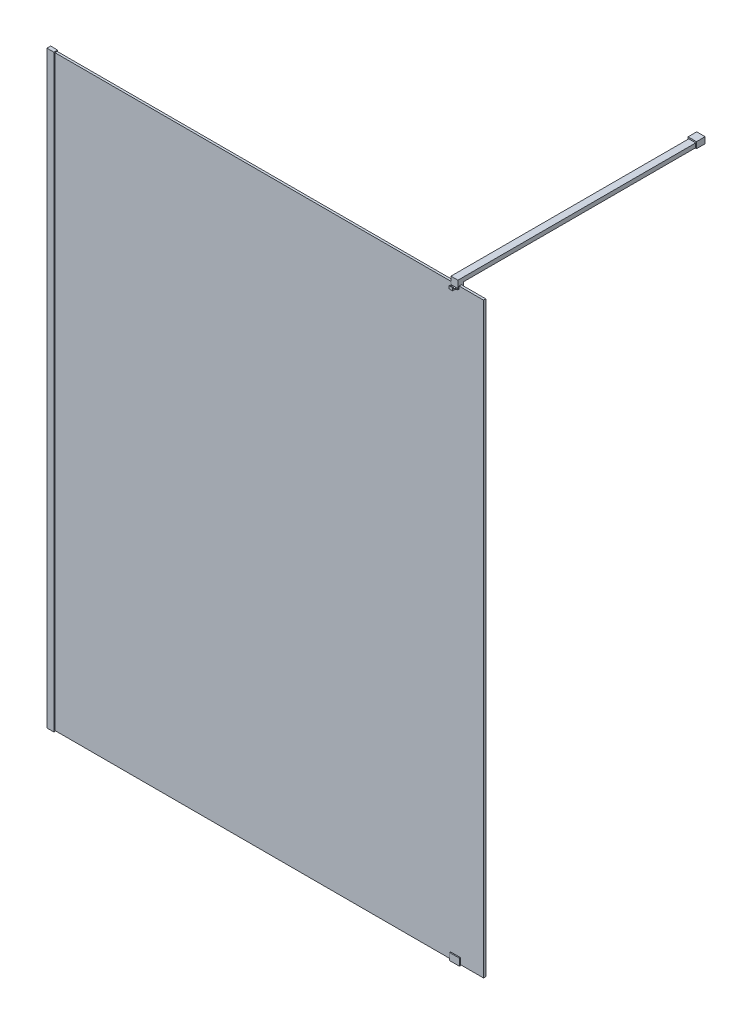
SolidWorks part; units mm, degrees
ref_plane "Płaszczyzna przednia" through (0, 0, 0) normal (0, 0, 1) x (1, 0, 0)
ref_plane "Płaszczyzna górna" through (0, 0, 0) normal (0, 1, 0) x (1, 0, 0)
ref_plane "Płaszczyzna prawa" through (0, 0, 0) normal (1, 0, 0) x (0, 0, -1)
sketch "Szkic1" plane through (0, 0, 0) normal (0, 1, 0) x (1, 0, 0)
  line L0 (0, 0) -> (0, 13.3)
  line L2 (0, 13.3) -> (25, 13.3)
  line L3 (25, 13.3) -> (25, 11.4)
  line L4 (25, 11.4) -> (11.45, 11.4)
  line L5 (11.45, 11.4) -> (11.45, 3.4)
  line L6 (11.45, 3.4) -> (25, 3.4)
  line L7 (25, 3.4) -> (25, 0)
  line L8 (25, 0) -> (0, 0)
  dimension "D1" = 13.3
  dimension "D4" = 1.9
  dimension "D5" = 8
  dimension "D6" = 3.4
  dimension "D7" = 13.55
  dimension "D8" = 25
extrude "Dodanie-wyciągnięcie1" add sketch "Szkic1" along normal blind 2100
sketch "Szkic2" plane through (0, 0, 0) normal (0, -1, 0) x (1, 0, 0)
  line L0 (11.45, -3.4) -> (1558.45, -3.4)
  line L1 (11.45, -3.4) -> (11.45, -11.4)
  line L2 (1558.45, -3.4) -> (1558.45, -11.4)
  line L3 (11.45, -11.4) -> (1558.45, -11.4)
  line L4 (11.45, -11.4) -> (25, -11.4) construction
  dimension "D1" = 1547
extrude "Dodanie-wyciągnięcie2" add sketch "Szkic2" against normal blind 2100 separate body
sketch "Szkic4" plane through (0, 2100, 0) normal (0, 1, 0) x (1, 0, 0)
  line L1 (25, 13.3) -> (0, 13.3) construction
  line L2 (25, 11.4) -> (25, 13.3) construction
  line L3 (0, 13.3) -> (0, 0) construction
  line L5 (0, 0) -> (25, 0) construction
  line L7 (25, 13.3) -> (0, 13.3)
  line L8 (25, 0) -> (25, 13.3)
  line L9 (0, 13.3) -> (0, 0)
  line L11 (0, 0) -> (25, 0)
extrude "Dodanie-wyciągnięcie3" add sketch "Szkic4" along normal blind 3
sketch "Szkic5" plane through (0, 0, 0) normal (0, -1, 0) x (1, 0, 0)
  line L1 (0, 0) -> (25, 0) construction
  line L2 (25, 0) -> (25, -3.4) construction
  line L3 (0, -13.3) -> (0, 0) construction
  line L5 (25, -13.3) -> (0, -13.3) construction
  line L7 (0, 0) -> (25, 0)
  line L8 (25, 0) -> (25, -13.3)
  line L9 (0, -13.3) -> (0, 0)
  line L11 (25, -13.3) -> (0, -13.3)
extrude "Dodanie-wyciągnięcie4" add sketch "Szkic5" along normal blind 3
ref_plane "Płaszczyzna1" through (1458.45, 0, 0) normal (1, 0, 0) x (0, 0, -1)
sketch "Szkic6" plane through (1458.45, 0, 0) normal (1, 0, 0) x (0, 0, -1)
  line L0 (11.4, 22) -> (15.75, 22)
  line L1 (15.75, 22) -> (15.75, -3)
  line L2 (15.75, -3) -> (-0.35, -3)
  line L3 (-0.35, -3) -> (-0.35, 22)
  line L4 (-0.35, 22) -> (3.4, 22)
  line L5 (11.4, 22) -> (11.4, 0)
  line L6 (11.4, 0) -> (11.4, 2100)
  line L7 (11.4, 0) -> (11.4, 2100) construction
  line L8 (3.4, 2100) -> (3.4, 0)
  line L9 (3.4, 2100) -> (3.4, 0) construction
  line L10 (11.4, 0) -> (3.4, 0)
  line L11 (3.4, 0) -> (3.4, 22)
  dimension "D1" = 4.35
  dimension "D2" = 25
  dimension "D3" = 3
  dimension "D4" = 3.75
extrude "Dodanie-wyciągnięcie5" add sketch "Szkic6" along normal mid plane 35 separate body
sketch "Szkic7" plane through (1458.45, 0, 0) normal (1, 0, 0) x (0, 0, -1)
  line L0 (3.4, 2100) -> (3.4, 0) construction
  line L1 (-0.6, 2120) -> (19.4, 2120)
  line L2 (3.4, 2100) -> (3.4, 0) construction
  line L4 (11.4, 2100) -> (3.4, 2100) construction
  line L13 (11.4, 2100) -> (11.4, 0) construction
  line L20 (19.4, 2120) -> (19.4, 2090)
  line L25 (19.4, 2090) -> (11.4, 2090)
  line L26 (11.4, 2090) -> (11.4, 2100)
  line L27 (11.4, 2100) -> (3.4, 2100)
  line L28 (3.4, 2100) -> (3.4, 2090)
  line L29 (3.4, 2090) -> (-13.37, 2090)
  line L30 (-13.37, 2090) -> (-13.37, 2100)
  line L31 (-13.37, 2100) -> (-10.37, 2100)
  line L32 (-10.37, 2100) -> (-9.8451, 2094)
  line L33 (-9.8451, 2094) -> (-0.6, 2094)
  line L34 (-0.6, 2094) -> (-0.6, 2120)
  dimension "D3" = 20
  dimension "D4" = 30
  dimension "D5" = 16.77
  dimension "D6" = 4
  dimension "D14" = 8
  dimension "D21" = 10
  dimension "D22" = 4
  dimension "D23" = 3
  dimension "D24" = 95
extrude "Dodanie-wyciągnięcie6" add sketch "Szkic7" along normal mid plane 25 separate body
sketch "Szkic8" plane through (0, 2100, 0) normal (0, 1, 0) x (1, 0, 0)
  line L0 (1445.95, -0.6) -> (1452.45, -3.631)
  line L1 (1452.45, -3.631) -> (1452.45, -13.37)
  line L2 (1470.95, -0.6) -> (1464.45, -3.631)
  line L3 (1464.45, -3.631) -> (1464.45, -13.37)
  line L4 (1458.45, -10.37) -> (1458.45, 156.6902) construction
  line L5 (1470.95, -10.37) -> (1445.95, -10.37) construction
  line L6 (1452.45, -13.37) -> (1464.45, -13.37)
  line L7 (1470.95, -13.37) -> (1445.95, -13.37) construction
  dimension "D1" = 12
  dimension "D2" = 115
extrude "Wytnij-wyciągnięcie1" cut sketch "Szkic8" against normal through all and the other way through all
sketch "Szkic10" plane through (0, 2120, 0) normal (0, 1, 0) x (1, 0, 0)
  line L0 (1458.45, 31.9) -> (1458.45, 19.4) construction
  line L1 (1445.95, 881.03) -> (1470.95, 881.03)
  line L2 (1445.95, 881.03) -> (1445.95, 19.4)
  line L3 (1445.95, 19.4) -> (1470.95, 19.4)
  line L4 (1470.95, 19.4) -> (1445.95, 19.4) construction
  line L5 (1445.95, 19.4) -> (1445.95, -0.6) construction
  line L6 (1470.95, 881.03) -> (1470.95, 19.4)
  point P4 (1458.45, 31.9)
  dimension "D2" = 861.63
  dimension "D1" = 25
  dimension "D3" = 12.5
extrude "Dodanie-wyciągnięcie7" add sketch "Szkic10" against normal blind 15
sketch "Szkic14" plane through (0, 0, -881.03) normal (0, 0, -1) x (-1, 0, 0)
  line L1 (-1473.45, 2125) -> (-1443.45, 2125)
  line L2 (-1473.45, 2125) -> (-1473.45, 2103)
  line L3 (-1473.45, 2103) -> (-1443.45, 2103)
  line L4 (-1443.45, 2125) -> (-1443.45, 2103)
  line L5 (-1473.45, 2125) -> (-1443.45, 2103) construction
  line L6 (-1473.45, 2103) -> (-1443.45, 2125) construction
  line L7 (-1458.45, 2120) -> (-1458.45, 2114) construction
  line L8 (-1470.95, 2120) -> (-1445.95, 2120) construction
  line L9 (-1470.95, 2105) -> (-1445.95, 2105) construction
  point P0 (-1458.45, 2114)
  dimension "D1" = 30
  dimension "D2" = 22
  dimension "D3" = 2
extrude "Dodanie-wyciągnięcie8" add sketch "Szkic14" against normal blind 31
